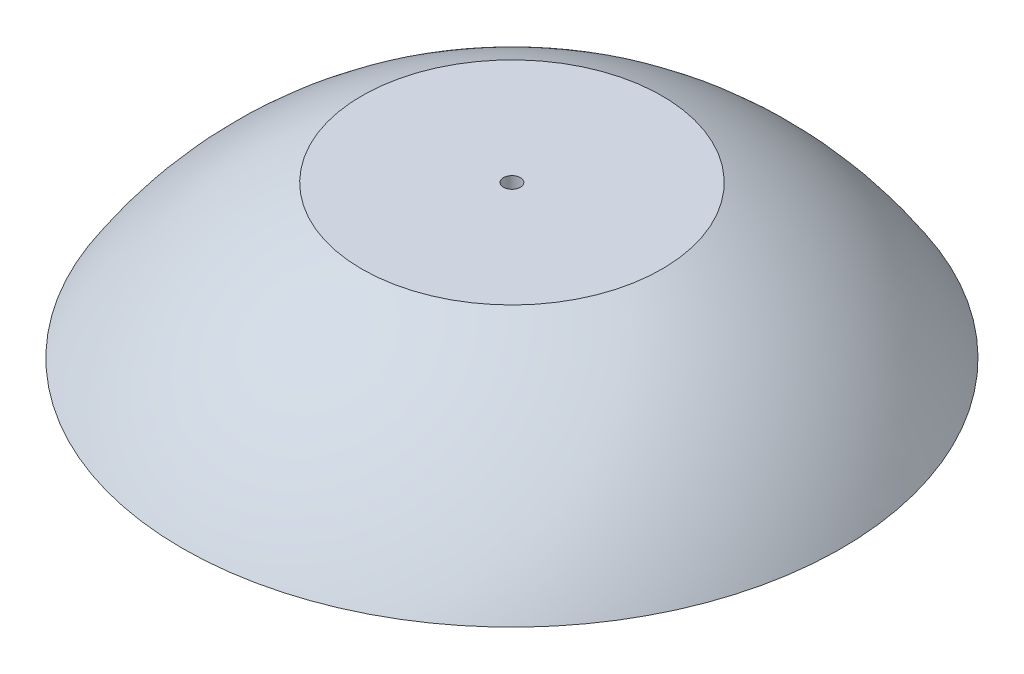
SolidWorks part; units mm, degrees
ref_plane "Front Plane" through (0, 0, 0) normal (0, 0, 1) x (1, 0, 0)
ref_plane "Top Plane" through (0, 0, 0) normal (0, 1, 0) x (1, 0, 0)
ref_plane "Right Plane" through (0, 0, 0) normal (1, 0, 0) x (0, 0, -1)
sketch "Sketch2" plane through (0, 0, 0) normal (1, 0, 0) x (0, 0, -1)
  line L0 (-39.74, 41.8351) -> (-51.2586, 41.8351)
  line L1 (-92.2015, -1.5895) -> (-103.8971, -1.5895)
  line L2 (0, 55.0789) -> (0, 48.1851)
  line L3 (-90.614, 3.7351) -> (-90.614, -0.002)
  line L4 (0, 48.1851) -> (-36.565, 48.1851)
  line L5 (0, 55.0789) -> (-44.398, 55.0789)
  line L7 (-38.1525, 46.5976) -> (-38.1525, 43.4226)
  line L8 (-52.8461, 40.2476) -> (-52.8461, 37.0726)
  line L9 (-61.9953, 35.4851) -> (-54.4336, 35.4851)
  line L10 (-70.584, 29.1351) -> (-65.1703, 29.1351)
  line L11 (-63.5828, 33.8976) -> (-63.5828, 30.7226)
  line L12 (-72.1715, 27.5476) -> (-72.1715, 24.3726)
  line L13 (-77.7328, 22.7851) -> (-73.759, 22.7851)
  line L15 (0, 0) -> (0, 55.0789) construction
  line L17 (-83.8075, 16.4351) -> (-80.9078, 16.4351)
  line L18 (-89.0265, 10.0851) -> (-86.9825, 10.0851)
  line L19 (-79.3203, 21.1976) -> (-79.3203, 18.0226)
  line L20 (-85.395, 14.8476) -> (-85.395, 11.6726)
  line L21 (-90.614, 8.4976) -> (-90.614, 3.7351)
  arc A2 (-89.0265, 10.0851) -> (-90.614, 8.4976) centre (-89.0265, 8.4976) ccw
  arc A4 (-83.8075, 16.4351) -> (-85.395, 14.8476) centre (-83.8075, 14.8476) ccw
  arc A5 (-77.7328, 22.7851) -> (-79.3203, 21.1976) centre (-77.7328, 21.1976) ccw
  arc A6 (-70.584, 29.1351) -> (-72.1715, 27.5476) centre (-70.584, 27.5476) ccw
  arc A7 (-61.9953, 35.4851) -> (-63.5828, 33.8976) centre (-61.9953, 33.8976) ccw
  arc A8 (-51.2586, 41.8351) -> (-52.8461, 40.2476) centre (-51.2586, 40.2476) ccw
  arc A9 (-36.565, 48.1851) -> (-38.1525, 46.5976) centre (-36.565, 46.5976) ccw
  arc A10 (-90.614, -0.002) -> (-92.2015, -1.5895) centre (-92.2015, -0.002) cw
  arc A11 (-85.395, 11.6726) -> (-86.9825, 10.0851) centre (-86.9825, 11.6726) cw
  arc A12 (-79.3203, 18.0226) -> (-80.9078, 16.4351) centre (-80.9078, 18.0226) cw
  arc A13 (-72.1715, 24.3726) -> (-73.759, 22.7851) centre (-73.759, 24.3726) cw
  arc A14 (-63.5828, 30.7226) -> (-65.1703, 29.1351) centre (-65.1703, 30.7226) cw
  arc A15 (-52.8461, 37.0726) -> (-54.4336, 35.4851) centre (-54.4336, 37.0726) cw
  arc A16 (-38.1525, 43.4226) -> (-39.74, 41.8351) centre (-39.74, 43.4226) cw
  arc A17 (-44.398, 55.0789) -> (-103.8971, -1.5895) centre (0, -51.1068) ccw
  point P11 (-39.9517, 55.0789)
  dimension "D4" = 6.35
  dimension "D10" = 1.5875
  dimension "D11" = 230.1875
  dimension "D1" = 6.35
  dimension "D5" = 6.35
  dimension "D6" = 6.35
  dimension "D7" = 6.35
  dimension "D8" = 6.35
  dimension "D9" = 39.9517
revolve "Revolve1" add sketch "Sketch2" angle 360 about L15
sketch "Sketch4" plane through (0, -1.5025, 0) normal (0, -1, 0) x (1, 0, 0)
  circle A0 centre (0, 0) radius 2.4892
  dimension "D1" = 4.9784
extrude "Cut-Extrude2" cut sketch "Sketch4" against normal through all
sketch "Sketch5" plane through (0, 48.1851, 0) normal (0, -1, 0) x (1, 0, 0)
  circle A0 centre (0, 0) radius 2.4892
  circle A1 centre (0, 0) radius 31.75
  dimension "D1" = 63.5
extrude "Boss-Extrude1" add sketch "Sketch5" along normal up to surface (49.7747 mm away)
sketch "Sketch6" plane through (0, 0, 0) normal (0, 0, 1) x (1, 0, 0)
  line L0 (-103.124, 8.4961) -> (103.124, 8.4961) construction
  line L1 (-130.0249, 10.0836) -> (118.2364, 10.0836)
  line L2 (-130.0249, 10.0836) -> (-130.0249, -3.5826)
  line L3 (-130.0249, -3.5826) -> (118.2364, -3.5826)
  line L4 (118.2364, 10.0836) -> (118.2364, -3.5826)
  dimension "D1" = 1.5875
extrude "Cut-Extrude3" cut sketch "Sketch6" against normal through all and the other way through all
sketch "Sketch7" plane through (0, 0, 0) normal (0, 0, 1) x (1, 0, 0)
  line L0 (44.398, 55.0789) -> (-44.398, 55.0789) construction
  line L1 (0, 61.4898) -> (0, 0) construction
  circle A0 centre (34.925, 44.9189) radius 3.175
  circle A1 centre (39.2845, 32.3212) radius 3.175
  circle A2 centre (36.0573, 38.5273) radius 3.175
  circle A3 centre (49.3383, 38.5273) radius 3.175
  circle A4 centre (42.884, 38.5273) radius 3.175
  circle A5 centre (46.2353, 32.3212) radius 3.175
  circle A6 centre (52.9378, 32.3212) radius 3.175
  circle A7 centre (59.6404, 32.3212) radius 3.175
  circle A8 centre (36.0573, 26.1151) radius 3.175
  circle A9 centre (42.884, 26.1151) radius 3.175
  circle A10 centre (49.3383, 26.1151) radius 3.175
  circle A11 centre (56.4132, 26.1151) radius 3.175
  circle A12 centre (62.8676, 26.1151) radius 3.175
  circle A13 centre (69.0736, 26.1151) radius 3.175
  circle A14 centre (72.7973, 19.6608) radius 3.175
  circle A15 centre (66.2189, 19.6608) radius 3.175
  circle A16 centre (59.6404, 19.6608) radius 3.175
  circle A17 centre (52.9378, 19.6608) radius 3.175
  circle A18 centre (46.2353, 19.6608) radius 3.175
  circle A19 centre (39.2845, 19.6608) radius 3.175
  circle A20 centre (36.0573, 13.2065) radius 3.175
  circle A21 centre (42.884, 13.2065) radius 3.175
  circle A22 centre (49.3383, 13.2065) radius 3.175
  circle A23 centre (56.4132, 13.2065) radius 3.175
  circle A24 centre (62.8676, 13.2065) radius 3.175
  circle A25 centre (69.0736, 13.2065) radius 3.175
  circle A26 centre (75.6521, 13.2065) radius 3.175
  circle A27 centre (82.1064, 13.2065) radius 3.175
  dimension "D1" = 6.35
  dimension "D2" = 10.16
  dimension "D3" = 34.925
  dimension "D4" = 36.0573
  dimension "D6" = 42.884
  dimension "D7" = 46.2353
  dimension "D8" = 49.3383
  dimension "D9" = 52.9378
  dimension "D10" = 56.4132
  dimension "D11" = 59.6404
  dimension "D12" = 62.8676
  dimension "D13" = 66.2189
  dimension "D14" = 69.0736
  dimension "D15" = 72.7973
  dimension "D16" = 75.6521
  dimension "D17" = 82.1064
  dimension "D5" = 39.2845
